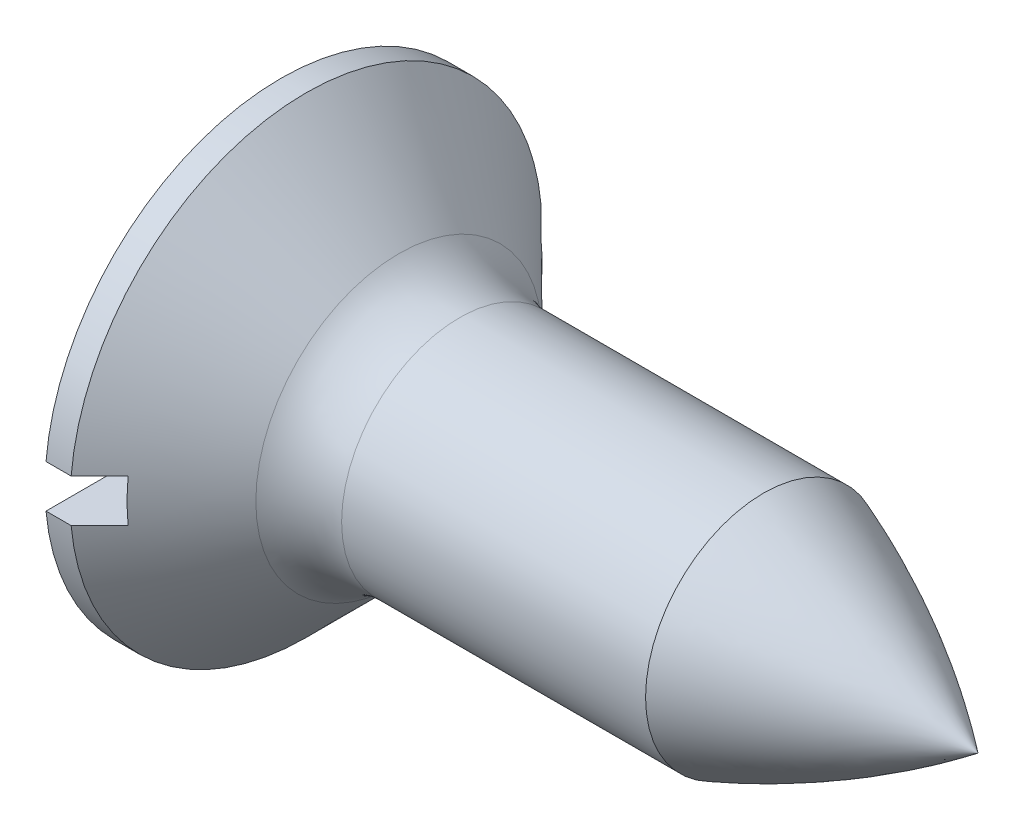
SolidWorks part; units mm, degrees
ref_plane "Front" through (0, 0, 0) normal (0, 0, 1) x (1, 0, 0)
ref_plane "Top" through (0, 0, 0) normal (0, 1, 0) x (1, 0, 0)
ref_plane "Right" through (0, 0, 0) normal (1, 0, 0) x (0, 0, -1)
sketch "Sketch1" plane through (0, 0, 0) normal (0, 0, 1) x (1, 0, 0)
  line L0 (-9.6945, 0) -> (41.8165, 0) construction
  line L1 (6.5, 0) -> (6.5, 1.1)
  line L2 (6.5, 1.1) -> (1.6657, 1.1)
  line L3 (1.1, 1.3343) -> (0.2343, 2.2)
  line L4 (0.2343, 2.2) -> (0, 2.2)
  line L5 (6.5, 0) -> (0, 0)
  line L6 (1.9, 2.8481) -> (1.9, -2.3177) construction
  line L7 (0, 2.2) -> (0, 0)
  arc A0 (1.6657, 1.1) -> (1.1, 1.3343) centre (1.6657, 1.9) cw
  dimension "D2" = 45
  dimension "r" = 0.8
  dimension "st" = 2.2
  dimension "k" = 1.1
  dimension "l" = 6.5
  dimension "dk" = 4.4
  dimension "a" = 0.8
revolve "Base" add sketch "Sketch1" angle 360 about L0
sketch "Sketch2" plane through (0, 0, 0) normal (0, 0, 1) x (1, 0, 0)
  line L0 (0, 2.2) -> (0, -2.2) construction
  line L1 (0, 0.2) -> (0.5, 0.2)
  line L2 (0, 0.2) -> (0, -0.2)
  line L3 (0, -0.2) -> (0.5, -0.2)
  line L4 (0.5, 0.2) -> (0.5, -0.2)
  line L6 (1.1738, 0) -> (-4.2219, 0) construction
  dimension "n" = 0.4
  dimension "t" = 0.5
extrude "Slot" cut sketch "Sketch2" against normal through all and the other way through all
sketch "Sketch3" plane through (0, 0, 0) normal (0, 0, 1) x (1, 0, 0)
  line L0 (1.3282, 0) -> (-13.6388, 0) construction
  line L1 (1.6657, -1.1) -> (6.5, -1.1) construction
  line L2 (4.9, -1.1) -> (5.7, -1.1)
  line L3 (5.7, -1.1) -> (6.5, -0.9)
  line L6 (4.9, -1.1) -> (4.9, -1.6)
  line L7 (4.9, -1.6) -> (6.5, -1.6)
  line L8 (6.5, -1.6) -> (6.5, -0.9)
  line L9 (6.5, -1.1) -> (6.5, 1.1) construction
  point P15 (5.7, -1.1)
  dimension "yf" = 1.6
  dimension "D2" = 0.8
  dimension "D3" = 0.2
  dimension "D4" = 0.5
revolve "Cut-Revolve1" [suppressed] cut sketch "Sketch3" angle 360 about L0
sketch "Sketch4" plane through (0, 0, 0) normal (0, 0, 1) x (1, 0, 0)
  line L0 (33.2407, 0) -> (9.9121, 0) construction
  line L2 (6.5, -1.1) -> (6.5, 1.1) construction
  line L3 (6.5, 0) -> (4.5, -1.1) construction
  line L6 (6.5, 0) -> (7, 0)
  line L7 (4.5, -1.1) -> (6.5, -1.1)
  line L8 (7, 0) -> (7, -1.1)
  line L9 (7, -1.1) -> (6.5, -1.1)
  arc A0 (6.5, 0) -> (4.5, -1.1) centre (1.6841, 6.388) cw
  dimension "D1" = 8
  dimension "D2" = 0.5
  dimension "yc" = 2
  dimension "D3" = 2.2
revolve "Cut-Revolve6" cut sketch "Sketch4" angle 360 about L0
sketch "Sketch5" plane through (0, 0, 0) normal (0, 0, 1) x (1, 0, 0)
  line L0 (1.65, 1.6) -> (2.15, 1.6)
  line L1 (2.15, 1.6) -> (2.15, 1.1)
  line L2 (2.15, 1.1) -> (1.9, 0.667)
  line L3 (1.9, 0.667) -> (1.65, 1.1)
  line L4 (1.65, 1.1) -> (1.65, 1.6)
  line L5 (0, 0) -> (8.4251, 0) construction
  dimension "D1" = 2.2
  dimension "D2" = 0.5
  dimension "D3" = 0.8
revolve "Cut-Revolve10" [suppressed] cut sketch "Sketch5" angle 360 about L5
pattern_linear "LPattern10" [suppressed] count 8 spacing 0.6 along (1, 0, 0)
equation "\"D3@Sketch3\" = \"yf@Sketch3\" / 8"
equation "\"D2@ThreadCosmetic1\" = \"st@Sketch1\" - 1"
equation "\"D1@Sketch4\" = \"yc@Sketch4\" * 4"
equation "\"D3@Sketch4\" = \"st@Sketch1\""
equation "\"D2@Sketch3\" = \"yf@Sketch3\" / 2"
equation "\"D1@ThreadCosmetic1\" = \"l@Sketch1\" - \"k@Sketch1\" - \"a@Sketch1\""
equation "\"D1@Sketch5\" = \"st@Sketch1\""
equation "\"D2@Sketch5\" =  ( \"D1@Sketch5\" - \"D2@ThreadCosmetic1\" )  / 2"
equation "\"D3@Sketch5\" = \"a@Sketch1\""
equation "\"D3@LPattern10\" = \"D2@Sketch5\" * 1.2"
equation "\"D1@LPattern10\" = \"D1@ThreadCosmetic1\" / \"D3@LPattern10\""
